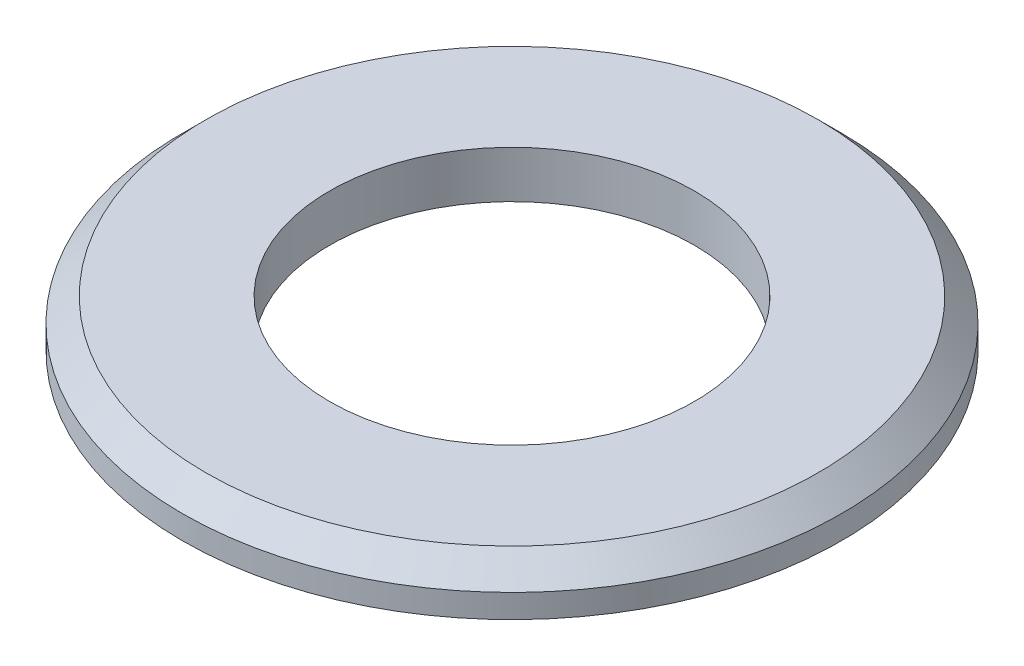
SolidWorks part; units mm, degrees
ref_plane "Front" through (0, 0, 0) normal (0, 0, 1) x (1, 0, 0)
ref_plane "Top" through (0, 0, 0) normal (0, 1, 0) x (1, 0, 0)
ref_plane "Right" through (0, 0, 0) normal (1, 0, 0) x (0, 0, -1)
sketch "Sketch1" plane through (0, 0, 0) normal (0, 1, 0) x (1, 0, 0)
  circle A0 centre (0, 0) radius 15.5
  circle A1 centre (0, 0) radius 28
extrude "Extrude1" add sketch "Sketch1" along normal blind 4
chamfer "Chamfer1" distance 2 1 edges at (0, 4, 28)
